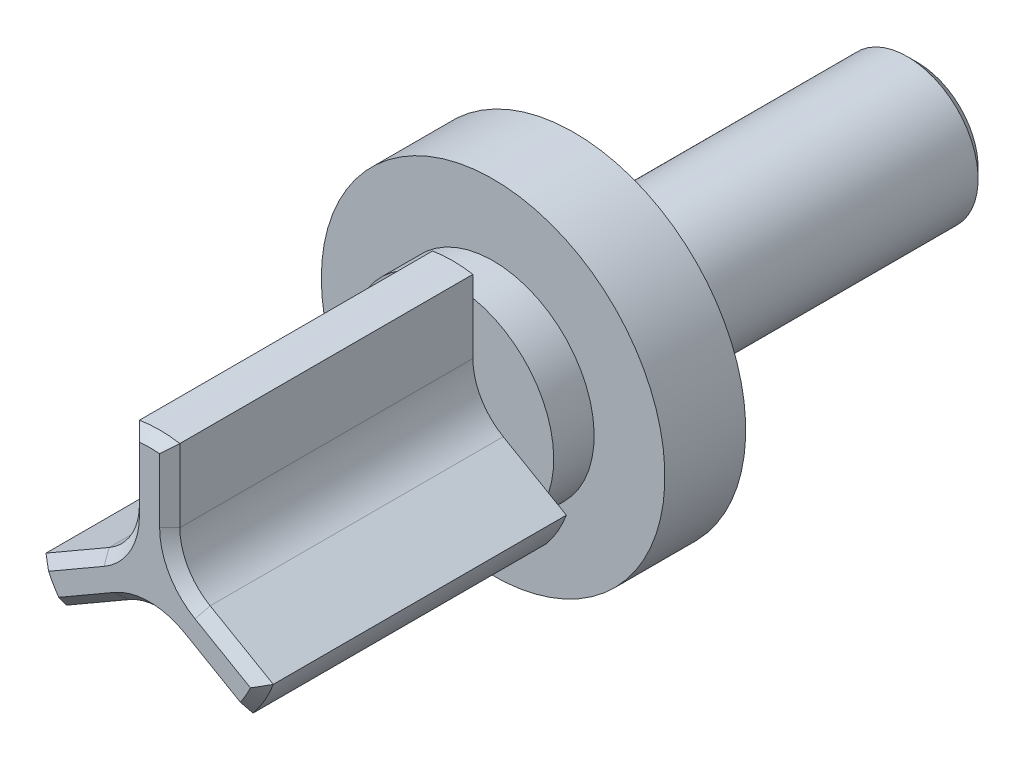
SolidWorks part; units mm, degrees
ref_plane "前视" through (0, 0, 0) normal (0, 0, 1) x (1, 0, 0)
ref_plane "上视" through (0, 0, 0) normal (0, 1, 0) x (1, 0, 0)
ref_plane "右视" through (0, 0, 0) normal (1, 0, 0) x (0, 0, -1)
sketch "草图1" plane through (0, 0, 0) normal (0, 0, 1) x (1, 0, 0)
  line L0 (-1, 2.3094) -> (-1, 5.9161)
  line L1 (1, 2.3094) -> (1, 5.9161)
  line L3 (1.5, -2.0207) -> (4.6235, -3.8241)
  line L4 (2.5, -0.2887) -> (5.6235, -2.092)
  line L5 (-2.5, -0.2887) -> (-5.6235, -2.092)
  line L6 (-1.5, -2.0207) -> (-4.6235, -3.8241)
  arc A0 (1, 5.9161) -> (-1, 5.9161) centre (0, 0) ccw
  arc A1 (1, 2.3094) -> (2.5, -0.2887) centre (4, 2.3094) ccw
  arc A2 (-5.6235, -2.092) -> (-4.6235, -3.8241) centre (0, 0) ccw
  arc A3 (4.6235, -3.8241) -> (5.6235, -2.092) centre (0, 0) ccw
  arc A4 (1.5, -2.0207) -> (-1.5, -2.0207) centre (0, -4.6188) ccw
  arc A5 (-2.5, -0.2887) -> (-1, 2.3094) centre (-4, 2.3094) ccw
  dimension "D1" = 12
  dimension "D3" = 3
  dimension "D4" = 6
  dimension "D2" = 2
extrude "拉伸1" add sketch "草图1" along normal blind 15
sketch "草图2" plane through (0, 0, 0) normal (0, 0, -1) x (-1, 0, 0)
  circle A0 centre (0, 0) radius 5
  dimension "D1" = 10
extrude "拉伸2" add sketch "草图2" along normal blind 2
sketch "草图3" plane through (0, 0, -2) normal (0, 0, -1) x (-1, 0, 0)
  circle A0 centre (0, 0) radius 8.5
  dimension "D1" = 17
extrude "拉伸3" add sketch "草图3" along normal blind 4
sketch "草图4" plane through (0, 0, -6) normal (0, 0, -1) x (-1, 0, 0)
  circle A0 centre (0, 0) radius 3.5
  circle A1 centre (0, 0) radius 8.5 construction
  dimension "D1" = 7
extrude "拉伸4" add sketch "草图4" along normal blind 17
chamfer "倒角1" distance 0.5 angle 45
chamfer "倒角2" distance 0.5 angle 45
